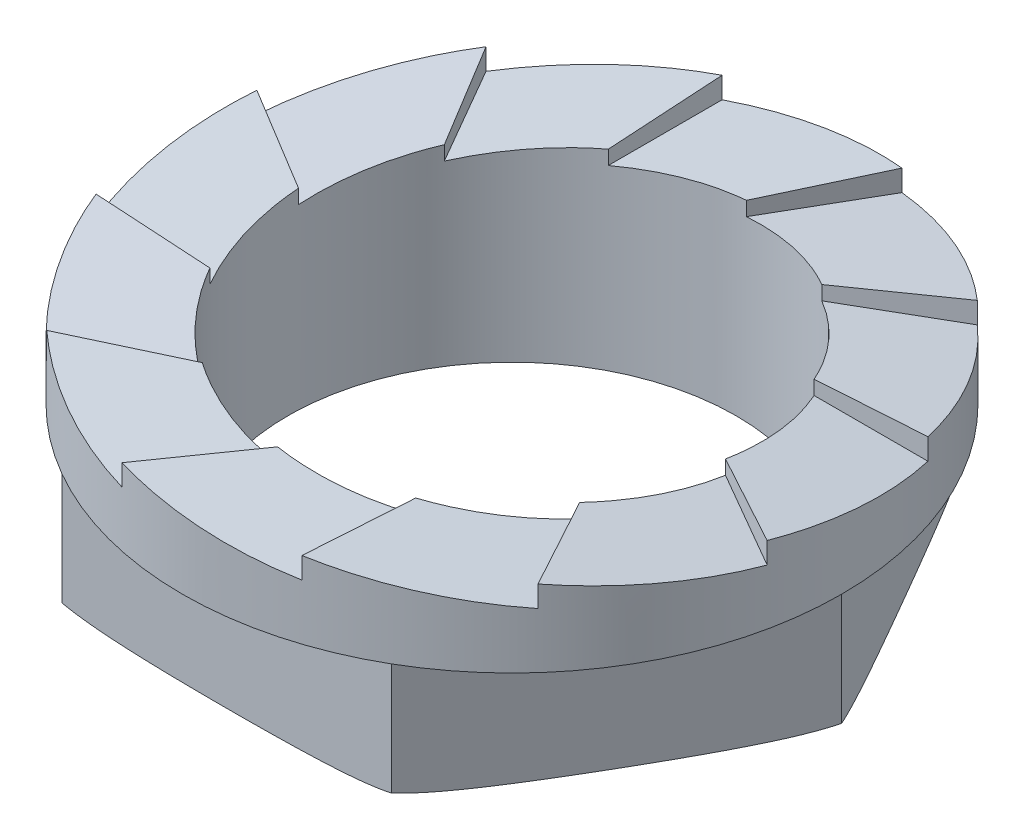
SolidWorks part; units mm, degrees
ref_plane "Plan de face" through (0, 0, 0) normal (0, 0, 1) x (1, 0, 0)
ref_plane "Plan de dessus" through (0, 0, 0) normal (0, 1, 0) x (1, 0, 0)
ref_plane "Plan de droite" through (0, 0, 0) normal (1, 0, 0) x (0, 0, -1)
sketch "Esquisse1" plane through (0, 0, 0) normal (0, 1, 0) x (1, 0, 0)
  line L1 (8.0829, 0) -> (4.0415, 7)
  line L2 (4.0415, 7) -> (-4.0415, 7)
  line L3 (-4.0415, 7) -> (-8.0829, 0)
  line L4 (-8.0829, 0) -> (-4.0415, -7)
  line L5 (-4.0415, -7) -> (4.0415, -7)
  line L6 (4.0415, -7) -> (8.0829, 0)
  circle A0 centre (0, 0) radius 7 construction
  dimension "D1" = 14
extrude "Boss.-Extru.1" add sketch "Esquisse1" along normal blind 3
sketch "Esquisse2" plane through (0, 3, 0) normal (0, 1, 0) x (1, 0, 0)
  circle A0 centre (0, 0) radius 8.0829
extrude "Boss.-Extru.2" add sketch "Esquisse2" along normal blind 2
sketch "Esquisse3" plane through (0, 0, 0) normal (0, -1, 0) x (1, 0, 0)
  circle A0 centre (0, 0) radius 5.5
  dimension "D1" = 11
extrude "Enlèv. mat.-Extru.1" cut sketch "Esquisse3" against normal through all
sketch "Esquisse4" plane through (0, 0, 0) normal (1, 0, 0) x (0, 0, -1)
  line L0 (0, 6.6205) -> (0, -2.5819) construction
  line L1 (0, 0) -> (-7, 0) construction
  line L2 (-7, 3) -> (-7, 0) construction
  line L3 (0, 0) -> (-7, 0) construction
  line L4 (-7, 3) -> (-7, 0) construction
  line L5 (-8.3003, 0.3804) -> (-8.5307, 0.3804)
  line L7 (-8.5307, -0.2935) -> (-5.9785, -0.2935)
  line L8 (-5.9785, -0.2935) -> (-5.9785, 0)
  line L9 (-8.5307, 0.3804) -> (-8.5307, -0.2935)
  spline S0 degree 3 poles (-5.9785, 0) (-7.234, 0.0039) (-7.9535, 0.1159) (-8.3003, 0.3804) knots 0 0 0 0 1 1 1 1
revolve "Enlèvement de matière-Révolution1" cut sketch "Esquisse4" angle 360 about L0
sketch "Esquisse5" plane through (0, 5, 0) normal (0, 1, 0) x (1, 0, 0)
  line L0 (0, 0) -> (0, -8.8362)
  line L1 (0, 0) -> (2.587, -9.6547)
  line L2 (0, 0) -> (-2.5266, -9.4294)
sketch "Esquisse6" plane through (0, 0, 0) normal (0, 0, 1) x (1, 0, 0)
  line L3 (2.587, 5) -> (-2.5243, 4.3622)
  line L5 (-2.5243, 4.3622) -> (-2.5243, 5.9843)
  line L6 (-2.5243, 5.9843) -> (2.587, 5.9843)
  line L8 (0, 5) -> (2.587, 5) construction
  line L9 (2.587, 5.9843) -> (2.587, 5)
extrude "Enlèv. mat.-Extru.2" cut sketch "Esquisse6" against normal through all
pattern_circular "Répétition circulaire1" count 12 every 30 about axis through (0, 0, 0) along (0, 1, 0) of "Enlèv. mat.-Extru.2"
equation "\"D2@Esquisse5\"=\"D1@Esquisse5\""
